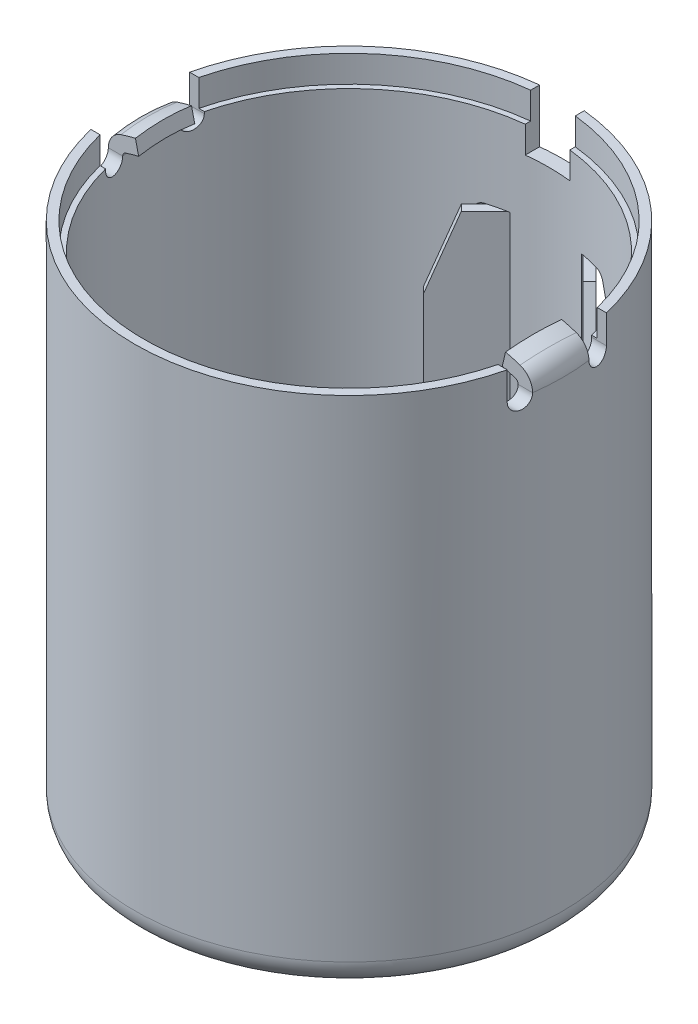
SolidWorks part; units mm, degrees
ref_plane "Plan1" through (0, 0, 0) normal (0, 0, 1) x (1, 0, 0)
ref_plane "Plan2" through (0, 0, 0) normal (0, 1, 0) x (1, 0, 0)
ref_plane "Plan3" through (0, 0, 0) normal (1, 0, 0) x (0, 0, -1)
sketch "Esquisse1" plane through (0, 0, 0) normal (0, 0, 1) x (1, 0, 0)
  line L0 (0, 0) -> (0, 78.6) construction
  line L1 (-3, 0) -> (-3, 1.6)
  line L2 (-3, 1.6) -> (-10.5, 1.6)
  line L3 (-12, 3.1) -> (-12, 30.6)
  line L4 (-11.2, 3.4) -> (-11.2, 29.1)
  line L5 (-2.5, 2.4) -> (-10.2, 2.4)
  line L7 (-2.5, 0) -> (-3, 0)
  line L8 (-12, 30.6) -> (-11.5, 30.6)
  line L9 (-2.5, 2.4) -> (-2.5, 0)
  line L11 (-11.5, 30.6) -> (-11.5, 29.1)
  line L12 (-11.5, 29.1) -> (-11.2, 29.1)
  arc A0 (-10.2, 2.4) -> (-11.2, 3.4) centre (-10.2, 3.4) cw
  arc A1 (-12, 3.1) -> (-10.5, 1.6) centre (-10.5, 3.1) ccw
  point P15 (-12, 1.6)
  dimension "D6" = 1
  dimension "D7" = 1.5
  dimension "D2" = 0.5
  dimension "D3" = 1.6
  dimension "D8" = 24
  dimension "D9" = 29
  dimension "D10" = 0.5
  dimension "D13" = 1.5
  dimension "D14" = 3
  dimension "D5" = 0.8
revolve "Base-Révolution" add sketch "Esquisse1" angle 180 about L0
sketch "Esquisse3" plane through (0, 1.6, 0) normal (0, -1, 0) x (1, 0, 0)
  line L2 (0, 0) -> (0, 17) construction
  line L3 (0, 0) -> (-18, 0) construction
  circle A4 centre (0, 7) radius 1.15
  dimension "D5" = 2.3
  dimension "D6" = 14
extrude "Enlèv. mat.-Extru.3" cut sketch "Esquisse3" against normal through all
mirror "Bossage-Symétrie1"
sketch "Esquisse6" plane through (0, 0, 0) normal (0, 0, 1) x (1, 0, 0)
  line L0 (2, 24.5) -> (2, 14.5)
  line L1 (2, 14.5) -> (4.5, 14.5)
  line L2 (5, 15) -> (5, 20.4093)
  line L3 (4.9682, 20.5849) -> (3.6217, 24.1756)
  line L4 (3.1535, 24.5) -> (2, 24.5)
  line L5 (0, 0) -> (0, 32.0156) construction
  line L7 (-3.1535, 24.5) -> (-2, 24.5)
  line L8 (-4.9682, 20.5849) -> (-3.6217, 24.1756)
  line L9 (-5, 15) -> (-5, 20.4093)
  line L10 (-2, 14.5) -> (-4.5, 14.5)
  line L11 (-2, 24.5) -> (-2, 14.5)
  arc A0 (3.6217, 24.1756) -> (3.1535, 24.5) centre (3.1535, 24) ccw
  arc A1 (5, 20.4093) -> (4.9682, 20.5849) centre (4.5, 20.4093) ccw
  arc A2 (4.5, 14.5) -> (5, 15) centre (4.5, 15) ccw
  arc A3 (-4.5, 14.5) -> (-5, 15) centre (-4.5, 15) cw
  arc A4 (-5, 20.4093) -> (-4.9682, 20.5849) centre (-4.5, 20.4093) cw
  arc A5 (-3.6217, 24.1756) -> (-3.1535, 24.5) centre (-3.1535, 24) cw
  point P12 (3.5, 24.5)
  point P15 (5, 20.5)
  point P18 (5, 14.5)
  dimension "D7" = 0.5
  dimension "D8" = 0.5
  dimension "D9" = 0.5
  dimension "D1" = 10
  dimension "D3" = 2
  dimension "D4" = 5
  dimension "D5" = 6
  dimension "D6" = 1.5
extrude "Enlèv. mat.-Extru.6" cut sketch "Esquisse6" against normal through all
ref_plane "Plan4" through (-6.9161, 0, -6.9161) normal (0.7071, 0, 0.7071) x (0.7071, 0, -0.7071)
sketch "Esquisse8" plane through (-6.9161, 0, -6.9161) normal (0.7071, 0, 0.7071) x (0.7071, 0, -0.7071)
  line L0 (6.9524, 14.5) -> (6.9524, 24.5)
  line L1 (6.9524, 24.5) -> (4.4524, 24.5)
  line L2 (4.4524, 24.5) -> (2.9524, 20.5)
  line L3 (2.9524, 20.5) -> (2.9524, 14.5)
  line L4 (2.9524, 14.5) -> (6.9524, 14.5)
  line L6 (6.9524, 14.5) -> (6.9524, 24.5) construction
  dimension "D1" = 4
  dimension "D2" = 2.5
  dimension "D3" = 10
  dimension "D4" = 10
  dimension "D5" = 4
  dimension "D6" = 6
extrude "Boss.-Extru.2" add sketch "Esquisse8" along normal blind 0.5
ref_plane "Plan5" through (6.9161, 0, -6.9161) normal (-0.7071, 0, 0.7071) x (0.7071, 0, 0.7071)
sketch "Esquisse9" plane through (6.9161, 0, -6.9161) normal (-0.7071, 0, 0.7071) x (0.7071, 0, 0.7071)
  line L0 (-6.9524, 24.5) -> (-6.9524, 14.5)
  line L1 (-6.9524, 14.5) -> (-2.9524, 14.5)
  line L7 (-2.9524, 20.8115) -> (-2.9524, 14.5)
  line L8 (-4.4524, 24.5) -> (-2.9524, 20.8115)
  line L9 (-6.9524, 24.5) -> (-4.4524, 24.5)
  dimension "D1" = 10
  dimension "D2" = 10
  dimension "D3" = 4
  dimension "D4" = 4
  dimension "D5" = 2.5
extrude "Boss.-Extru.3" add sketch "Esquisse9" along normal blind 0.5
fillet "Congé8" radius 1 1 edges
fillet "Congé9" radius 1 1 edges at (-2, 19.5, -11.8322)
sketch "Esquisse13" plane through (0, 0, 0) normal (0, 0, 1) x (1, 0, 0)
  line L0 (0, 27.6) -> (0, 30.6)
  line L1 (11.5, 30.6) -> (-11.5, 30.6) construction
  dimension "D1" = 3
extrude "Enlèv. de mat.-Extru.-Mince1" cut sketch "Esquisse13" along normal blind 1 and the other way up to next thin
sketch "Esquisse16" plane through (0, 0, 0) normal (1, 0, 0) x (0, 0, -1)
  line L0 (0, 29) -> (0, 30.6)
  line L1 (11.4319, 30.6) -> (-11.5, 30.6) construction
  line L2 (2.7468, 29) -> (2.7468, 30.6)
  line L3 (-2.7998, 29) -> (-2.7998, 30.6)
  line L4 (2.7468, 30.6) -> (-2.7998, 30.6)
  line L5 (1.5468, 29) -> (-1.5998, 29)
  arc A0 (2.7468, 29) -> (1.5468, 29) centre (2.1468, 29) cw
  arc A1 (-2.7998, 29) -> (-1.5998, 29) centre (-2.1998, 29) ccw
  dimension "D2" = 0.6
  dimension "D3" = 0.6
  dimension "D1" = 1.6
extrude "Enlèv. mat.-Extru.7" cut sketch "Esquisse16" against normal through all and the other way through all contours A0 L2 L4 L0 L5 | L3 A1 L5 L0 L4
ref_plane "Plan6" through (0, 0, 1.5998) normal (0, 0, 1) x (1, 0, 0)
sketch "Esquisse19" plane through (0, 0, 1.5998) normal (0, 0, 1) x (1, 0, 0)
  line L0 (-11.8929, 29) -> (-11.8929, 28.2671) construction
  arc A0 (-11.8929, 29) -> (-11.1852, 29.9876) centre (-10.85, 29) cw
  arc A1 (-11.1852, 29.9876) -> (-10.3725, 30.2187) centre (-8.4782, 22.0123) cw
sketch3d "Esquisse3D1"
  line L1 (-11.8999, 29, -1.5468) -> (-11.0927, 29, -1.5468)
  line L2 (-11.8929, 29, 1.5998) -> (-11.0852, 29, 1.5998)
  arc A0 (-11.8929, 29, 1.5998) -> (-11.8999, 29, -1.5468) centre (0, 29, 0) cw
  arc A2 (-11.0927, 29, -1.5468) -> (-11.0852, 29, 1.5998) centre (0, 29, 0) cw
  point P2 (0, 17, 0)
  point P8 (0, 40.2, 0)
sweep "Balayage1" add profiles "Esquisse3D1" path "Esquisse19"
sketch "Esquisse20" plane through (0, 1.6, 0) normal (0, -1, 0) x (1, 0, 0)
  line L1 (8.5, 1.3) -> (10, 1.3)
  line L2 (8.5, 1.3) -> (8.5, -1.3)
  line L3 (8.5, -1.3) -> (10, -1.3)
  line L4 (10, 1.3) -> (10, -1.3)
  dimension "D1" = 10
  dimension "D2" = 1.5
  dimension "D3" = 1.3
  dimension "D4" = 1.3
extrude "Enlèv. mat.-Extru.8" cut sketch "Esquisse20" against normal through all
sketch "Esquisse21" plane through (10, 0, 0) normal (-1, 0, 0) x (0, 0, 1)
  line L0 (1.3, 1.6) -> (0.8, 2.1)
  line L1 (0.8, 2.1) -> (-0.8, 2.1)
  line L2 (-0.8, 2.1) -> (-1.3, 1.6)
  line L3 (-1.3, 1.6) -> (1.3, 1.6) construction
  dimension "D1" = 0.5
  dimension "D2" = 45
  dimension "D3" = 45
extrude "Extru.-Mince1" add sketch "Esquisse21" along normal blind 1.5 thin
mirror "Symétrie1" about plane through (0, 0, 0) normal (1, 0, 0) of "Extru.-Mince1", "Balayage1", "Enlèv. mat.-Extru.8"
fillet "Congé10" radius 0.6 4 edges at (9.25, 1.6, -1.3) (9.25, 1.6, 1.3) (-9.25, 1.6, 1.3) (-9.25, 1.6, -1.3)
fillet "Congé11" radius 0.05 5 edges at (0, 1.6, -3) (9.25, 2.1, -0.8) (9.25, 2.1, 0.8) (-9.25, 2.1, -0.8) (-9.25, 2.1, 0.8)
